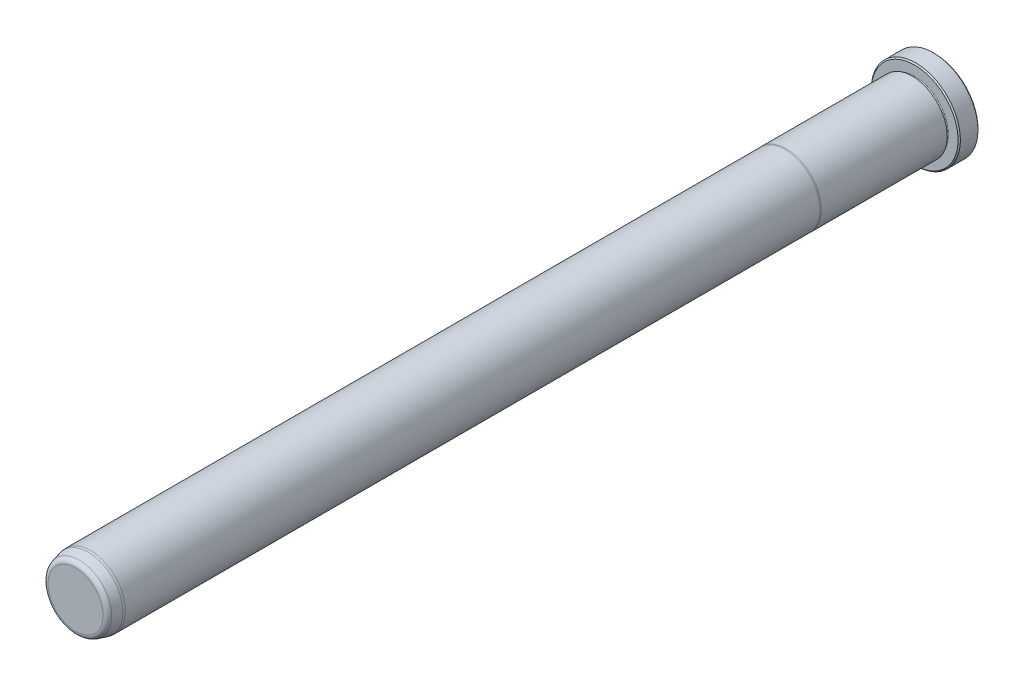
SolidWorks part; units mm, degrees
ref_plane "Front Plane" through (0, 0, 0) normal (0, 0, 1) x (1, 0, 0)
ref_plane "Top Plane" through (0, 0, 0) normal (0, 1, 0) x (1, 0, 0)
ref_plane "Right Plane" through (0, 0, 0) normal (1, 0, 0) x (0, 0, -1)
sketch "Sketch1" plane through (0, 0, 0) normal (1, 0, 0) x (0, 0, -1)
  line L0 (0, 0) -> (0, 14.1605)
  line L1 (0, 14.1605) -> (-6.35, 14.1605)
  line L2 (-6.35, 14.1605) -> (-6.35, 10.7188)
  line L3 (-6.35, 10.3378) -> (-7.112, 10.3378) construction
  line L4 (-7.112, 10.7188) -> (-7.112, 11.1252)
  line L5 (-7.112, 11.1252) -> (-47.1348, 11.1252)
  line L6 (-47.1348, 11.1252) -> (-47.498, 11.0998)
  line L7 (-47.498, 11.0998) -> (-268.2875, 11.0998)
  line L9 (-273.05, 9.9612) -> (-273.05, 0)
  line L10 (-273.05, 0) -> (0, 0)
  line L11 (0, 0) -> (13.6287, 0) construction
  line L12 (-268.2875, 11.0998) -> (-269.0495, 11.0331)
  line L13 (-269.0495, 11.0331) -> (-273.05, 9.9612)
  arc A0 (-7.112, 10.7188) -> (-6.35, 10.7188) centre (-6.731, 10.7188) ccw
  dimension "D14" = 0.762
  dimension "D1" = 6.35
  dimension "D2" = 0.762
  dimension "D3" = 28.321
  dimension "D4" = 22.2504
  dimension "D5" = 47.498
  dimension "D6" = 273.05
  dimension "D7" = 0.7874
  dimension "D8" = 4
  dimension "D9" = 22.1996
  dimension "D10" = 5
  dimension "D11" = 15
  dimension "D12" = 0.762
  dimension "D13" = 4.7625
revolve "Revolve1" add sketch "Sketch1" angle 360 about L11
fillet "Fillet6" radius 1.5875 1 edges at (9.9612, 0, 273.05)
chamfer "Chamfer1" distance 0.381 angle 45 2 edges at (14.1605, 0, 0) (14.1605, 0, 6.35)
